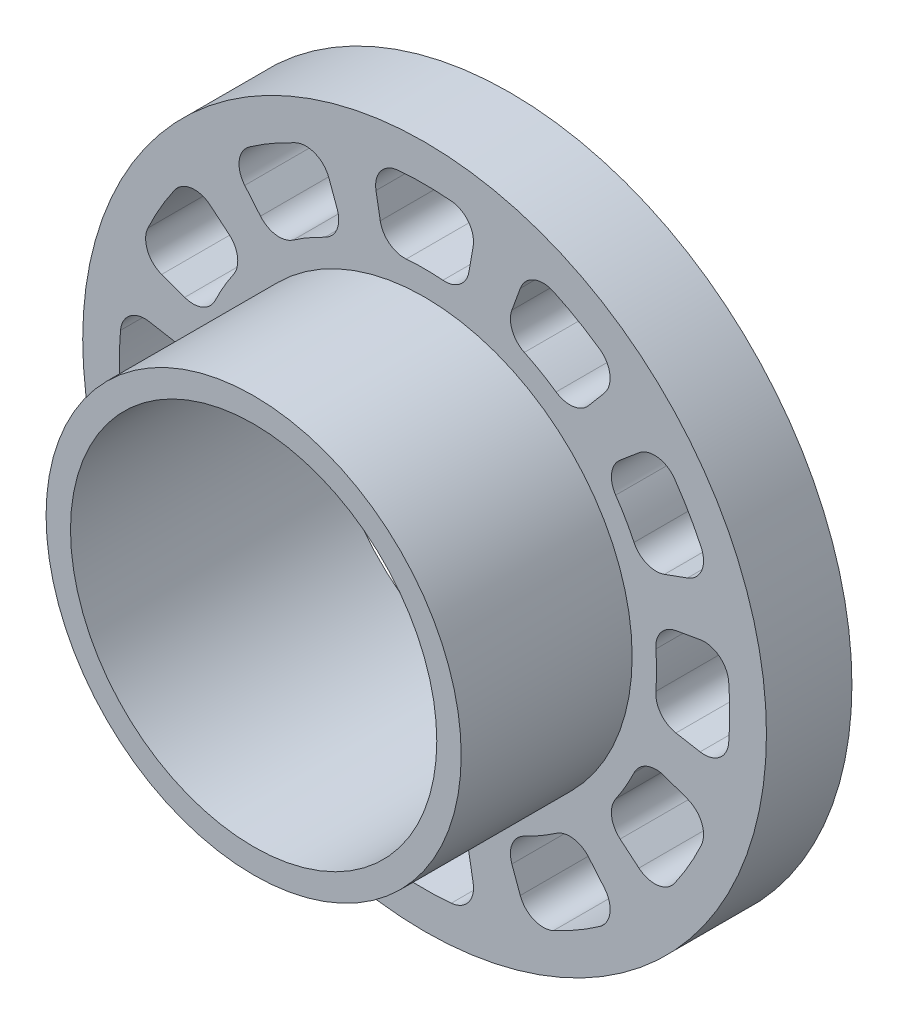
SolidWorks part; units mm, degrees
ref_plane "Front Plane" through (0, 0, 0) normal (0, 0, 1) x (1, 0, 0)
ref_plane "Top Plane" through (0, 0, 0) normal (0, 1, 0) x (1, 0, 0)
ref_plane "Right Plane" through (0, 0, 0) normal (1, 0, 0) x (0, 0, -1)
sketch "Sketch1" plane through (0, 0, 0) normal (0, 0, 1) x (1, 0, 0)
  line L0 (0, 22.4079) -> (0, -21.8065) construction
  line L1 (-24.4619, 0) -> (27.3728, 0) construction
  line L2 (-10.2935, -1.815) -> (-11.2824, -1.9894)
  line L3 (-10.2935, 1.815) -> (-11.2824, 1.9894)
  line L4 (-8.0069, 6.7186) -> (-8.7761, 7.3641)
  line L5 (-9.8219, 3.5749) -> (-10.7655, 3.9183)
  line L6 (-3.5749, 9.8219) -> (-3.9183, 10.7655)
  line L7 (-6.7186, 8.0069) -> (-7.3641, 8.7761)
  line L8 (1.815, 10.2935) -> (1.9894, 11.2824)
  line L9 (-1.815, 10.2935) -> (-1.9894, 11.2824)
  line L10 (6.7186, 8.0069) -> (7.3641, 8.7761)
  line L11 (3.5749, 9.8219) -> (3.9183, 10.7655)
  line L12 (9.8219, 3.5749) -> (10.7655, 3.9183)
  line L13 (8.0069, 6.7186) -> (8.7761, 7.3641)
  line L14 (10.2935, -1.815) -> (11.2824, -1.9894)
  line L15 (10.2935, 1.815) -> (11.2824, 1.9894)
  line L16 (8.0069, -6.7186) -> (8.7761, -7.3641)
  line L17 (9.8219, -3.5749) -> (10.7655, -3.9183)
  line L18 (3.5749, -9.8219) -> (3.9183, -10.7655)
  line L19 (6.7186, -8.0069) -> (7.3641, -8.7761)
  line L20 (-1.815, -10.2935) -> (-1.9894, -11.2824)
  line L21 (1.815, -10.2935) -> (1.9894, -11.2824)
  line L22 (-6.7186, -8.0069) -> (-7.3641, -8.7761)
  line L23 (-3.5749, -9.8219) -> (-3.9183, -10.7655)
  line L24 (-9.8219, -3.5749) -> (-10.7655, -3.9183)
  line L25 (-8.0069, -6.7186) -> (-8.7761, -7.3641)
  circle A0 centre (0, 0) radius 14
  circle A2 centre (0, 0) radius 7.5
  arc A3 (-9.4703, 0.7511) -> (-9.4703, -0.7511) centre (0, 0) ccw
  arc A4 (-12.4522, 1.0919) -> (-12.4522, -1.0919) centre (0, 0) ccw
  arc A5 (-10.2935, -1.815) -> (-9.4703, -0.7511) centre (-10.4671, -0.8302) ccw
  arc A6 (-10.2935, 1.815) -> (-9.4703, 0.7511) centre (-10.4671, 0.8302) cw
  arc A7 (-11.2824, -1.9894) -> (-12.4522, -1.0919) centre (-11.456, -1.0046) cw
  arc A8 (-11.2824, 1.9894) -> (-12.4522, 1.0919) centre (-11.456, 1.0046) ccw
  arc A9 (-10.238, 7.1718) -> (-11.3299, 5.2805) centre (0, 0) ccw
  arc A10 (-8.7761, 7.3641) -> (-10.238, 7.1718) centre (-9.4189, 6.598) ccw
  arc A11 (-8.0069, 6.7186) -> (-7.8259, 5.3856) centre (-8.6497, 5.9525) cw
  arc A12 (-9.8219, 3.5749) -> (-8.5771, 4.0846) centre (-9.4799, 4.5146) ccw
  arc A13 (-7.8259, 5.3856) -> (-8.5771, 4.0846) centre (0, 0) ccw
  arc A14 (-10.7655, 3.9183) -> (-11.3299, 5.2805) centre (-10.4235, 4.858) cw
  arc A15 (-5.2805, 11.3299) -> (-7.1718, 10.238) centre (0, 0) ccw
  arc A16 (-3.9183, 10.7655) -> (-5.2805, 11.3299) centre (-4.858, 10.4235) ccw
  arc A17 (-3.5749, 9.8219) -> (-4.0846, 8.5771) centre (-4.5146, 9.4799) cw
  arc A18 (-6.7186, 8.0069) -> (-5.3856, 7.8259) centre (-5.9525, 8.6497) ccw
  arc A19 (-4.0846, 8.5771) -> (-5.3856, 7.8259) centre (0, 0) ccw
  arc A20 (-7.3641, 8.7761) -> (-7.1718, 10.238) centre (-6.598, 9.4189) cw
  arc A21 (1.0919, 12.4522) -> (-1.0919, 12.4522) centre (0, 0) ccw
  arc A22 (1.9894, 11.2824) -> (1.0919, 12.4522) centre (1.0046, 11.456) ccw
  arc A23 (1.815, 10.2935) -> (0.7511, 9.4703) centre (0.8302, 10.4671) cw
  arc A24 (-1.815, 10.2935) -> (-0.7511, 9.4703) centre (-0.8302, 10.4671) ccw
  arc A25 (0.7511, 9.4703) -> (-0.7511, 9.4703) centre (0, 0) ccw
  arc A26 (-1.9894, 11.2824) -> (-1.0919, 12.4522) centre (-1.0046, 11.456) cw
  arc A27 (7.1718, 10.238) -> (5.2805, 11.3299) centre (0, 0) ccw
  arc A28 (7.3641, 8.7761) -> (7.1718, 10.238) centre (6.598, 9.4189) ccw
  arc A29 (6.7186, 8.0069) -> (5.3856, 7.8259) centre (5.9525, 8.6497) cw
  arc A30 (3.5749, 9.8219) -> (4.0846, 8.5771) centre (4.5146, 9.4799) ccw
  arc A31 (5.3856, 7.8259) -> (4.0846, 8.5771) centre (0, 0) ccw
  arc A32 (3.9183, 10.7655) -> (5.2805, 11.3299) centre (4.858, 10.4235) cw
  arc A33 (11.3299, 5.2805) -> (10.238, 7.1718) centre (0, 0) ccw
  arc A34 (10.7655, 3.9183) -> (11.3299, 5.2805) centre (10.4235, 4.858) ccw
  arc A35 (9.8219, 3.5749) -> (8.5771, 4.0846) centre (9.4799, 4.5146) cw
  arc A36 (8.0069, 6.7186) -> (7.8259, 5.3856) centre (8.6497, 5.9525) ccw
  arc A37 (8.5771, 4.0846) -> (7.8259, 5.3856) centre (0, 0) ccw
  arc A38 (8.7761, 7.3641) -> (10.238, 7.1718) centre (9.4189, 6.598) cw
  arc A39 (12.4522, -1.0919) -> (12.4522, 1.0919) centre (0, 0) ccw
  arc A40 (11.2824, -1.9894) -> (12.4522, -1.0919) centre (11.456, -1.0046) ccw
  arc A41 (10.2935, -1.815) -> (9.4703, -0.7511) centre (10.4671, -0.8302) cw
  arc A42 (10.2935, 1.815) -> (9.4703, 0.7511) centre (10.4671, 0.8302) ccw
  arc A43 (9.4703, -0.7511) -> (9.4703, 0.7511) centre (0, 0) ccw
  arc A44 (11.2824, 1.9894) -> (12.4522, 1.0919) centre (11.456, 1.0046) cw
  arc A45 (10.238, -7.1718) -> (11.3299, -5.2805) centre (0, 0) ccw
  arc A46 (8.7761, -7.3641) -> (10.238, -7.1718) centre (9.4189, -6.598) ccw
  arc A47 (8.0069, -6.7186) -> (7.8259, -5.3856) centre (8.6497, -5.9525) cw
  arc A48 (9.8219, -3.5749) -> (8.5771, -4.0846) centre (9.4799, -4.5146) ccw
  arc A49 (7.8259, -5.3856) -> (8.5771, -4.0846) centre (0, 0) ccw
  arc A50 (10.7655, -3.9183) -> (11.3299, -5.2805) centre (10.4235, -4.858) cw
  arc A51 (5.2805, -11.3299) -> (7.1718, -10.238) centre (0, 0) ccw
  arc A52 (3.9183, -10.7655) -> (5.2805, -11.3299) centre (4.858, -10.4235) ccw
  arc A53 (3.5749, -9.8219) -> (4.0846, -8.5771) centre (4.5146, -9.4799) cw
  arc A54 (6.7186, -8.0069) -> (5.3856, -7.8259) centre (5.9525, -8.6497) ccw
  arc A55 (4.0846, -8.5771) -> (5.3856, -7.8259) centre (0, 0) ccw
  arc A56 (7.3641, -8.7761) -> (7.1718, -10.238) centre (6.598, -9.4189) cw
  arc A57 (-1.0919, -12.4522) -> (1.0919, -12.4522) centre (0, 0) ccw
  arc A58 (-1.9894, -11.2824) -> (-1.0919, -12.4522) centre (-1.0046, -11.456) ccw
  arc A59 (-1.815, -10.2935) -> (-0.7511, -9.4703) centre (-0.8302, -10.4671) cw
  arc A60 (1.815, -10.2935) -> (0.7511, -9.4703) centre (0.8302, -10.4671) ccw
  arc A61 (-0.7511, -9.4703) -> (0.7511, -9.4703) centre (0, 0) ccw
  arc A62 (1.9894, -11.2824) -> (1.0919, -12.4522) centre (1.0046, -11.456) cw
  arc A63 (-7.1718, -10.238) -> (-5.2805, -11.3299) centre (0, 0) ccw
  arc A64 (-7.3641, -8.7761) -> (-7.1718, -10.238) centre (-6.598, -9.4189) ccw
  arc A65 (-6.7186, -8.0069) -> (-5.3856, -7.8259) centre (-5.9525, -8.6497) cw
  arc A66 (-3.5749, -9.8219) -> (-4.0846, -8.5771) centre (-4.5146, -9.4799) ccw
  arc A67 (-5.3856, -7.8259) -> (-4.0846, -8.5771) centre (0, 0) ccw
  arc A68 (-3.9183, -10.7655) -> (-5.2805, -11.3299) centre (-4.858, -10.4235) cw
  arc A69 (-11.3299, -5.2805) -> (-10.238, -7.1718) centre (0, 0) ccw
  arc A70 (-10.7655, -3.9183) -> (-11.3299, -5.2805) centre (-10.4235, -4.858) ccw
  arc A71 (-9.8219, -3.5749) -> (-8.5771, -4.0846) centre (-9.4799, -4.5146) cw
  arc A72 (-8.0069, -6.7186) -> (-7.8259, -5.3856) centre (-8.6497, -5.9525) ccw
  arc A73 (-8.5771, -4.0846) -> (-7.8259, -5.3856) centre (0, 0) ccw
  arc A74 (-8.7761, -7.3641) -> (-10.238, -7.1718) centre (-9.4189, -6.598) cw
  point P14 (-9.3557, -1.6497)
  point P17 (-9.3557, 1.6497)
  point P20 (-12.3101, -2.1706)
  point P23 (-12.3101, 2.1706)
  point P158 (0, 0)
  dimension "D1" = 28
  dimension "D3" = 15
  dimension "D4" = 19
  dimension "D2" = 25
  dimension "D6" = 1
  dimension "D5" = 10
  dimension "D7" = 12
extrude "Boss-Extrude1" add sketch "Sketch1" along normal blind 3.5
sketch "Sketch2" plane through (0, 0, 3.5) normal (0, 0, 1) x (1, 0, 0)
  circle A0 centre (0, 0) radius 8.5
  circle A1 centre (0, 0) radius 7.5
  dimension "D1" = 17
  dimension "D2" = 15
extrude "Boss-Extrude2" add sketch "Sketch2" along normal blind 7
sketch "Sketch3" plane through (0, 0, 0) normal (1, 0, 0) x (0, 0, -1)
  line L0 (-7, 8.5) -> (-7, -9.6341) construction
  line L1 (-3.5, 8.5) -> (-10.5, 8.5) construction
  line L2 (-10.5, 0) -> (-3.5, 0) construction
  line L3 (-10.5, 8.5) -> (-10.5, -8.5) construction
  line L6 (-3.5, 8.5) -> (-3.5, -8.5) construction
  circle A0 centre (-7, 0) radius 0.75
  dimension "D1" = 1.5
ref_plane "Plane1" through (0, 8.5, 0) normal (0, 1, 0) x (1, 0, 0)
sketch "Sketch10" plane through (0, 0, 10.5) normal (0, 0, 1) x (1, 0, 0)
  circle A0 centre (0, 0) radius 7.5
  dimension "D1" = 15
